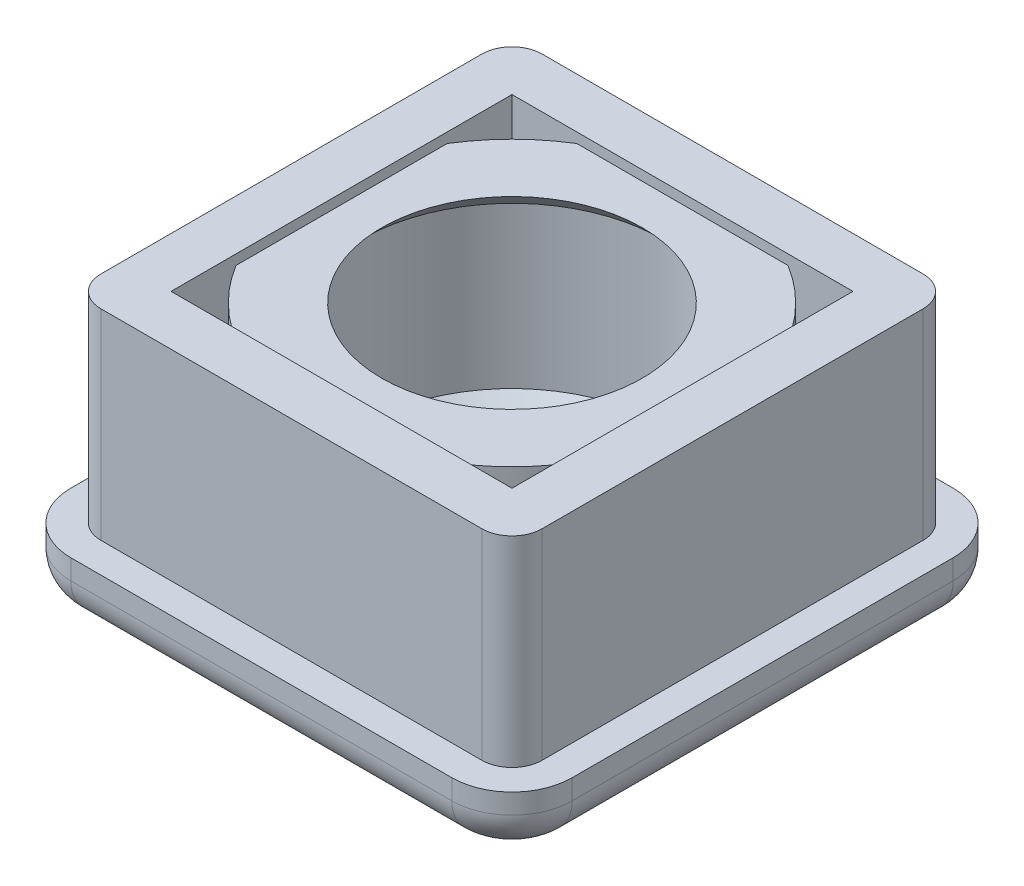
SolidWorks part; units mm, degrees
ref_plane "Front Plane" through (0, 0, 0) normal (0, 0, 1) x (1, 0, 0)
ref_plane "Top Plane" through (0, 0, 0) normal (0, 1, 0) x (1, 0, 0)
ref_plane "Right Plane" through (0, 0, 0) normal (1, 0, 0) x (0, 0, -1)
sketch "Sketch1" plane through (0, 0, 0) normal (0, 1, 0) x (1, 0, 0)
  line L1 (-9.5, -12.5) -> (9.5, -12.5)
  line L2 (-12.5, -9.5) -> (-12.5, 9.5)
  line L3 (-9.5, 12.5) -> (9.5, 12.5)
  line L4 (12.5, -9.5) -> (12.5, 9.5)
  line L5 (-12.5, -12.5) -> (12.5, 12.5) construction
  line L6 (-12.5, 12.5) -> (12.5, -12.5) construction
  arc A0 (9.5, -12.5) -> (12.5, -9.5) centre (9.5, -9.5) ccw
  arc A1 (9.5, 12.5) -> (12.5, 9.5) centre (9.5, 9.5) cw
  arc A2 (-12.5, 9.5) -> (-9.5, 12.5) centre (-9.5, 9.5) cw
  arc A3 (-9.5, -12.5) -> (-12.5, -9.5) centre (-9.5, -9.5) cw
  point P0 (0, 0)
  dimension "D3" = 3
  dimension "D1" = 25
  dimension "D2" = 25
extrude "Boss-Extrude1" add sketch "Sketch1" along normal blind 3
sketch "Sketch2" plane through (0, 3, 0) normal (0, 1, 0) x (1, 0, 0)
  line L8 (11, -9.5) -> (11, 9.5)
  line L9 (9.5, 11) -> (-9.5, 11)
  line L10 (-11, 9.5) -> (-11, -9.5)
  line L11 (-9.5, -11) -> (9.5, -11)
  line L12 (11, -9.5) -> (11, 9.5)
  line L13 (9.5, 11) -> (-9.5, 11)
  line L14 (-11, 9.5) -> (-11, -9.5)
  line L15 (-9.5, -11) -> (9.5, -11)
  arc A8 (9.5, -11) -> (11, -9.5) centre (9.5, -9.5) ccw
  arc A9 (11, 9.5) -> (9.5, 11) centre (9.5, 9.5) ccw
  arc A10 (-9.5, 11) -> (-11, 9.5) centre (-9.5, 9.5) ccw
  arc A11 (-11, -9.5) -> (-9.5, -11) centre (-9.5, -9.5) ccw
  arc A12 (9.5, -11) -> (11, -9.5) centre (9.5, -9.5) ccw
  arc A13 (11, 9.5) -> (9.5, 11) centre (9.5, 9.5) ccw
  arc A14 (-9.5, 11) -> (-11, 9.5) centre (-9.5, 9.5) ccw
  arc A15 (-11, -9.5) -> (-9.5, -11) centre (-9.5, -9.5) ccw
  dimension "D1" = 1.5
extrude "Boss-Extrude2" add sketch "Sketch2" along normal blind 10
shell "Shell1" thickness 2.5
sketch "Sketch3" plane through (0, 2.5, 0) normal (0, 1, 0) x (1, 0, 0)
  circle A0 centre (0, 0) radius 7.5
  circle A1 centre (0, 0) radius 10
  dimension "D1" = 15
  dimension "D2" = 20
extrude "Boss-Extrude3" add sketch "Sketch3" along normal blind 10
sketch "Sketch4" plane through (0, 0, 0) normal (0, -1, 0) x (1, 0, 0)
  circle A0 centre (0, 0) radius 4
  dimension "D1" = 8
extrude "Cut-Extrude1" cut sketch "Sketch4" against normal blind 10
sketch "Sketch5" plane through (0, 12.5, 0) normal (0, 1, 0) x (1, 0, 0)
  circle A0 centre (0, 0) radius 6.5
  circle A1 centre (0, 0) radius 7.5
  dimension "D1" = 13
extrude "Boss-Extrude4" add sketch "Sketch5" against normal blind 1
chamfer "Chamfer1" distance 1 angle 45 2 edges at (0, 11.5, 6.5) (0, 2.5, 7.5)
fillet "Fillet1" radius 2 8 edges at (-11.6213, 0, 11.6213) (-12.5, 0, 0) (-11.6213, 0, -11.6213) (0, 0, -12.5) (11.6213, 0, -11.6213) (12.5, 0, 0) (11.6213, 0, 11.6213) (0, 0, 12.5)
